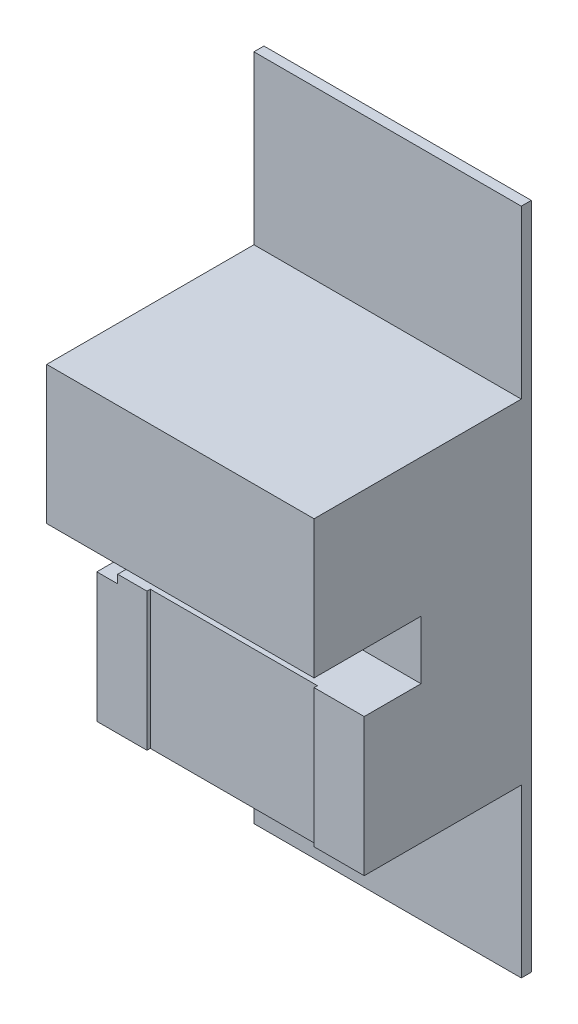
SolidWorks part; units mm, degrees
ref_plane "Front Plane" through (0, 0, 0) normal (0, 0, 1) x (1, 0, 0)
ref_plane "Top Plane" through (0, 0, 0) normal (0, 1, 0) x (1, 0, 0)
ref_plane "Right Plane" through (0, 0, 0) normal (1, 0, 0) x (0, 0, -1)
sketch "Sketch2" plane through (0, 0, 0) normal (0, 0, 1) x (1, 0, 0)
  line L1 (0, 0) -> (16, 0)
  line L2 (0, 0) -> (0, 40)
  line L3 (0, 40) -> (16, 40)
  line L4 (16, 0) -> (16, 40)
  dimension "D1" = 40
  dimension "D2" = 16
extrude "Boss-Extrude1" add sketch "Sketch2" along normal blind 10 contours L2 L3 L4 L1
sketch "Sketch3" plane through (0, 0, 10) normal (0, 0, 1) x (1, 0, 0)
  line L0 (0, 40) -> (16, 40) construction
  line L1 (0, 21.75) -> (16, 21.75)
  line L2 (0, 21.75) -> (0, 18.25)
  line L3 (0, 18.25) -> (16, 18.25)
  line L4 (16, 21.75) -> (16, 18.25)
  line L5 (16, 0) -> (16, 40) construction
  line L6 (0, 0) -> (0, 40) construction
  point P4 (8, 21.75)
  point P7 (8, 40)
  point P8 (16, 20)
  point P11 (16, 20)
  dimension "D1" = 3.5
extrude "Cut-Extrude1" cut sketch "Sketch3" against normal blind 3.4
sketch "Sketch4" plane through (0, 40, 0) normal (0, 1, 0) x (1, 0, 0)
  line L0 (8, -14.4) -> (8, -5.6) construction
  line L1 (6.2, -14.4) -> (6.2, -5.6)
  line L2 (9.8, -14.4) -> (9.8, -5.6)
  line L4 (0, -10) -> (16, -10) construction
  arc A0 (6.2, -14.4) -> (9.8, -14.4) centre (8, -14.4) ccw
  arc A1 (9.8, -5.6) -> (6.2, -5.6) centre (8, -5.6) ccw
  point P2 (8, -10)
  point P14 (8, -10)
  dimension "D1" = 1.8
  dimension "D2" = 8.8
extrude "Cut-Extrude3" cut sketch "Sketch4" against normal blind 3.4 from surface at -18.25
sketch "Sketch5" plane through (0, 0, 10) normal (0, 0, 1) x (1, 0, 0)
  line L0 (16, 0) -> (16, 18.25) construction
  line L1 (0, 40) -> (16, 40)
  line L2 (0, 40) -> (0, 30)
  line L3 (0, 30) -> (16, 30)
  line L4 (16, 40) -> (16, 30)
  line L6 (0, 0) -> (16, 0)
  line L7 (0, 0) -> (0, 10)
  line L8 (0, 10) -> (16, 10)
  line L9 (16, 0) -> (16, 10)
  dimension "D1" = 10
  dimension "D2" = 10
extrude "Cut-Extrude4" cut sketch "Sketch5" against normal offset from surface (9.4 mm away) 0.6
sketch "Sketch6" plane through (0, 0, 10) normal (0, 0, 1) x (1, 0, 0)
  line L1 (3, 18.25) -> (13, 18.25)
  line L2 (3, 18.25) -> (3, 9.25)
  line L3 (3, 9.25) -> (13, 9.25)
  line L4 (13, 18.25) -> (13, 9.25)
  line L6 (0, 18.25) -> (16, 18.25) construction
  point P6 (8, 18.25)
  point P7 (8, 18.25)
  dimension "D1" = 10
  dimension "D2" = 9
extrude "Cut-Extrude5" cut sketch "Sketch6" against normal blind 0.2
sketch "Sketch7" plane through (0, 0, 10) normal (0, 0, 1) x (1, 0, 0)
  line L1 (0, 30) -> (16, 30)
  line L2 (0, 30) -> (0, 21.75)
  line L3 (0, 21.75) -> (16, 21.75)
  line L4 (16, 30) -> (16, 21.75)
extrude "Boss-Extrude2" add sketch "Sketch7" along normal blind 3
sketch "Sketch8" plane through (0, 0, 10) normal (0, 0, 1) x (1, 0, 0)
  line L1 (0, 18.25) -> (1.25, 18.25)
  line L2 (0, 18.25) -> (0, 17.75)
  line L3 (0, 17.75) -> (1.25, 17.75)
  line L4 (1.25, 18.25) -> (1.25, 17.75)
  dimension "D1" = 1.25
  dimension "D2" = 0.5
extrude "Cut-Extrude6" cut sketch "Sketch8" against normal blind 1
